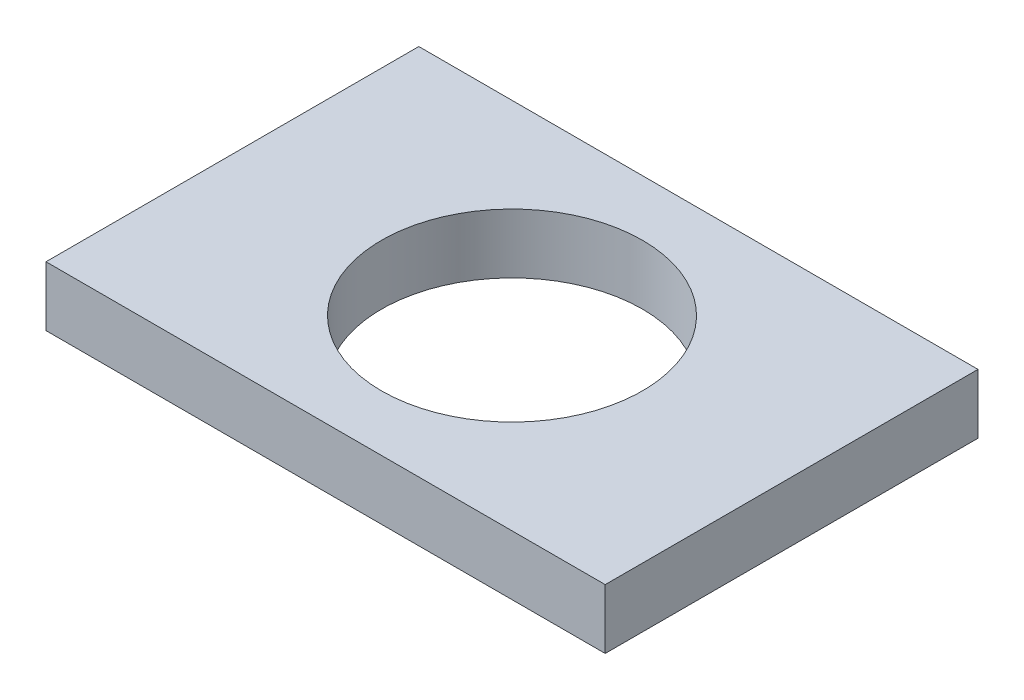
SolidWorks part; units mm, degrees
ref_plane "Face" through (0, 0, 0) normal (0, 0, 1) x (1, 0, 0)
ref_plane "Dessus" through (0, 0, 0) normal (0, 1, 0) x (1, 0, 0)
ref_plane "Droite" through (0, 0, 0) normal (1, 0, 0) x (0, 0, -1)
sketch "Esquisse1" plane through (0, 0, 0) normal (0, 0, 1) x (1, 0, 0)
  line L1 (-150, 0) -> (150, 0)
  line L2 (-150, 0) -> (-150, -32)
  line L3 (-150, -32) -> (150, -32)
  line L4 (150, 0) -> (150, -32)
  dimension "D1" = 150
  dimension "D3" = 32
extrude "Extrusion1" add sketch "Esquisse1" along normal mid plane 200
sketch "Esquisse2" plane through (0, 0, 0) normal (0, 1, 0) x (-1, 0, 0)
  circle A0 centre (0, 0) radius 70
  dimension "D1" = 140
extrude "Enlèv. mat.-Extru.1" cut sketch "Esquisse2" against normal through all
